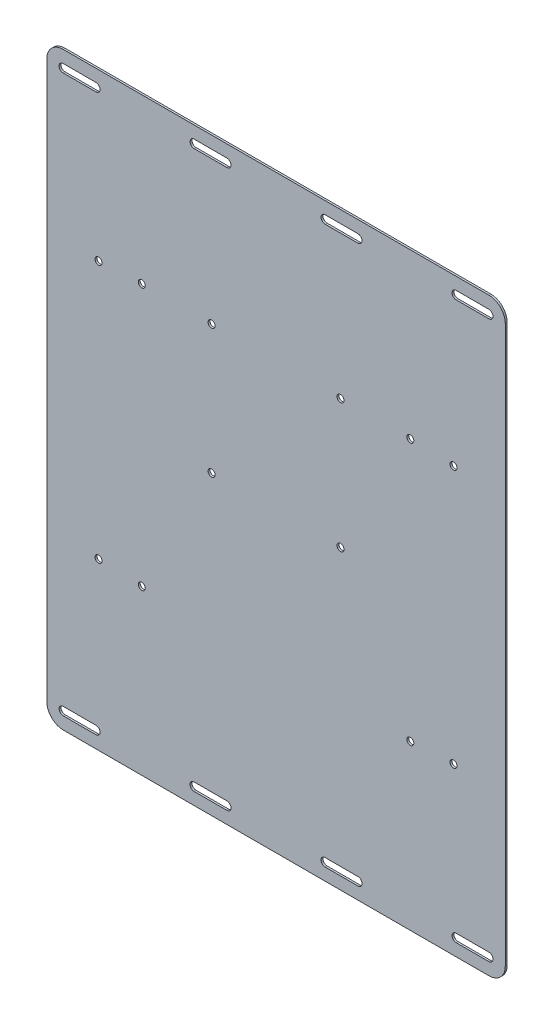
SolidWorks part; units mm, degrees
ref_plane "Front Plane" through (0, 0, 0) normal (0, 0, 1) x (1, 0, 0)
ref_plane "Top Plane" through (0, 0, 0) normal (0, 1, 0) x (1, 0, 0)
ref_plane "Right Plane" through (0, 0, 0) normal (1, 0, 0) x (0, 0, -1)
sketch "Sketch1" plane through (0, 0, 0) normal (0, 0, 1) x (1, 0, 0)
  line L0 (165.1, 228.6) -> (-165.1, 228.6)
  line L1 (165.1, -228.6) -> (-165.1, -228.6)
  line L2 (-177.8, -215.9) -> (-177.8, 215.9)
  line L3 (177.8, -215.9) -> (177.8, 215.9)
  line L4 (-139.7, -212.725) -> (-165.1, -212.725)
  line L5 (-139.7, -219.075) -> (-165.1, -219.075)
  line L6 (-38.1, -212.725) -> (-63.5, -212.725)
  line L7 (-38.1, -219.075) -> (-63.5, -219.075)
  line L8 (63.5, -212.725) -> (38.1, -212.725)
  line L9 (63.5, -219.075) -> (38.1, -219.075)
  line L10 (165.1, -212.725) -> (139.7, -212.725)
  line L11 (165.1, -219.075) -> (139.7, -219.075)
  line L12 (-139.7, 219.075) -> (-165.1, 219.075)
  line L13 (-139.7, 212.725) -> (-165.1, 212.725)
  line L14 (-38.1, 219.075) -> (-63.5, 219.075)
  line L15 (-38.1, 212.725) -> (-63.5, 212.725)
  line L16 (63.5, 219.075) -> (38.1, 219.075)
  line L17 (63.5, 212.725) -> (38.1, 212.725)
  line L18 (165.1, 219.075) -> (139.7, 219.075)
  line L19 (165.1, 212.725) -> (139.7, 212.725)
  line L20 (50, 101.6) -> (50, 1.6) construction
  line L21 (50, 1.6) -> (-50, 1.6) construction
  arc A0 (-139.7, -219.075) -> (-139.7, -212.725) centre (-139.7, -215.9) ccw
  arc A1 (-165.1, -212.725) -> (-165.1, -219.075) centre (-165.1, -215.9) ccw
  arc A2 (-177.8, -215.9) -> (-165.1, -228.6) centre (-165.1, -215.9) ccw
  arc A3 (-165.1, 228.6) -> (-177.8, 215.9) centre (-165.1, 215.9) ccw
  arc A4 (177.8, 215.9) -> (165.1, 228.6) centre (165.1, 215.9) ccw
  arc A5 (165.1, -228.6) -> (177.8, -215.9) centre (165.1, -215.9) ccw
  arc A6 (-38.1, -219.075) -> (-38.1, -212.725) centre (-38.1, -215.9) ccw
  arc A7 (-63.5, -212.725) -> (-63.5, -219.075) centre (-63.5, -215.9) ccw
  arc A8 (63.5, -219.075) -> (63.5, -212.725) centre (63.5, -215.9) ccw
  arc A9 (38.1, -212.725) -> (38.1, -219.075) centre (38.1, -215.9) ccw
  arc A10 (165.1, -219.075) -> (165.1, -212.725) centre (165.1, -215.9) ccw
  arc A11 (139.7, -212.725) -> (139.7, -219.075) centre (139.7, -215.9) ccw
  arc A12 (-139.7, 212.725) -> (-139.7, 219.075) centre (-139.7, 215.9) ccw
  arc A13 (-165.1, 219.075) -> (-165.1, 212.725) centre (-165.1, 215.9) ccw
  arc A14 (-38.1, 212.725) -> (-38.1, 219.075) centre (-38.1, 215.9) ccw
  arc A15 (-63.5, 219.075) -> (-63.5, 212.725) centre (-63.5, 215.9) ccw
  arc A16 (63.5, 212.725) -> (63.5, 219.075) centre (63.5, 215.9) ccw
  arc A17 (38.1, 219.075) -> (38.1, 212.725) centre (38.1, 215.9) ccw
  arc A18 (165.1, 212.725) -> (165.1, 219.075) centre (165.1, 215.9) ccw
  arc A19 (139.7, 219.075) -> (139.7, 212.725) centre (139.7, 215.9) ccw
  circle A20 centre (-104.14, 101.6) radius 2.7178
  circle A21 centre (-104.14, -101.6) radius 2.7178
  circle A22 centre (104.14, -101.6) radius 2.7178
  circle A23 centre (104.14, 101.6) radius 2.7178
  circle A24 centre (-137.668, 100.076) radius 2.7178
  circle A25 centre (-137.668, -100.076) radius 2.7178
  circle A26 centre (137.668, -100.076) radius 2.7178
  circle A27 centre (137.668, 100.076) radius 2.7178
  circle A28 centre (-50, 101.6) radius 2.7178
  circle A29 centre (50, 101.6) radius 2.7178
  circle A30 centre (50, 1.6) radius 2.7178
  circle A31 centre (-50, 1.6) radius 2.7178
  point P72 (0, 228.6)
  point P82 (0, 1.6)
  point P83 (0, 0)
  dimension "D1" = 5.4356
  dimension "D2" = 3.175
  dimension "D3" = 12.7
  dimension "D4" = 100
  dimension "D5" = 38.1
  dimension "D6" = 63.5
  dimension "D7" = 104.14
  dimension "D8" = 137.668
  dimension "D9" = 139.7
  dimension "D10" = 38.1
  dimension "D11" = 104.14
  dimension "D12" = 137.668
  dimension "D13" = 100
  dimension "D14" = 101.6
  dimension "D15" = 228.6
  dimension "D16" = 100.076
  dimension "D17" = 101.6
  dimension "D18" = 228.6
  dimension "D19" = 100.076
base flange "Base-Flange1" sketch "Sketch1" thickness 1.5 reverse thickness direction no parameters "D1"=1.5
sketch "Bend-Lines1" [suppressed] plane through (0, 0, 0) normal (0, 1, 0) x (1, 0, 0)
sketch "Bounding-Box1" [suppressed] plane through (0, 0, 0) normal (0, 1, 0) x (1, 0, 0)
sheet metal parameters "Sheet-Metal1" thickness 1.5 parameters "D1"=1.5
flat pattern "Flat-Pattern1"
sketch "Bend-Lines2" plane through (0, 0, 0) normal (0, 1, 0) x (1, 0, 0)
sketch3d "Bounding-Box2" [suppressed]
  line L0 (342.9, -12.7, 0) -> (342.9, 444.5, 0) construction
  line L1 (-12.7, -12.7, 0) -> (-12.7, 444.5, 0) construction
  line L2 (342.9, -12.7, 0) -> (-12.7, -12.7, 0) construction
  line L3 (342.9, 444.5, 0) -> (-12.7, 444.5, 0) construction
